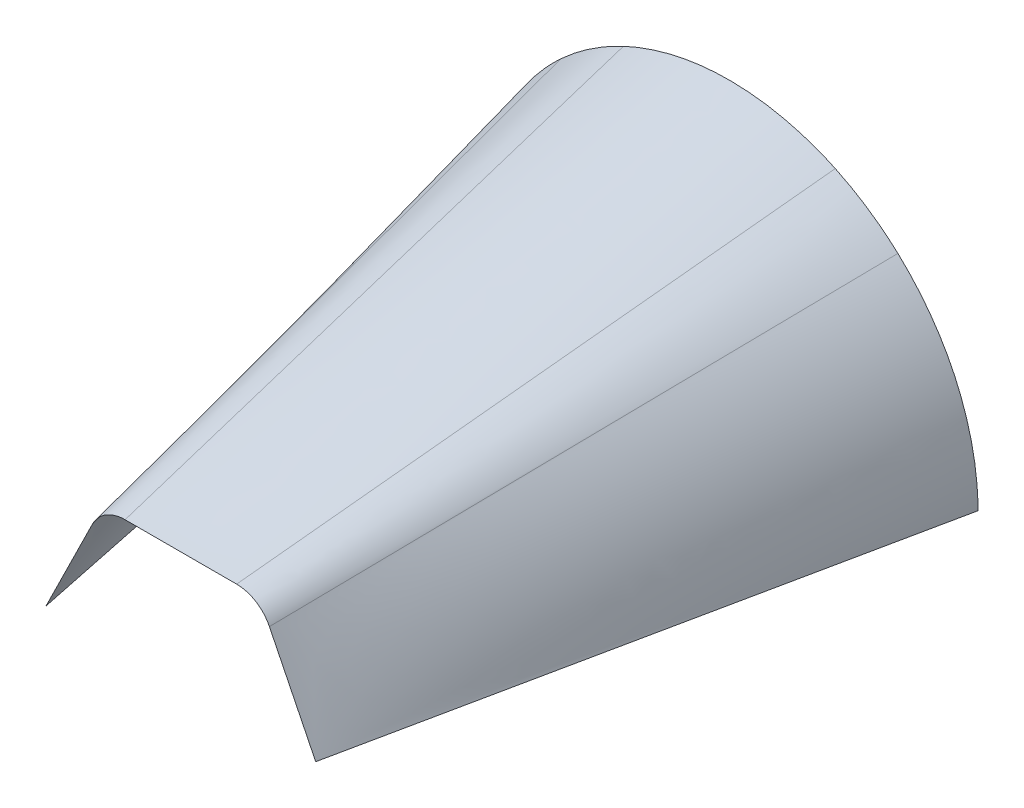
SolidWorks part; units mm, degrees
ref_plane "Front" through (0, 0, 0) normal (0, 0, 1) x (1, 0, 0)
ref_plane "Top" through (0, 0, 0) normal (0, 1, 0) x (1, 0, 0)
ref_plane "Right" through (0, 0, 0) normal (1, 0, 0) x (0, 0, -1)
sketch "Sketch1" plane through (0, 0, 0) normal (0, 0, 1) x (1, 0, 0)
  line L0 (-36.8792, 0) -> (-24.2187, 25.6729)
  line L1 (-15.25, 31.25) -> (15.25, 31.25)
  line L2 (24.2187, 25.6729) -> (36.8792, 0)
  line L3 (0, 31.25) -> (0, 0) construction
  arc A0 (-24.2187, 25.6729) -> (-15.25, 31.25) centre (-15.25, 21.25) cw
  arc A1 (15.25, 31.25) -> (24.2187, 25.6729) centre (15.25, 21.25) cw
  point P6 (0, 31.25)
  dimension "D1" = 10
  dimension "D2" = 30.5
  dimension "D3" = 31.25
  dimension "D4" = 52.5
ref_plane "Plane1" through (0, 0, -150) normal (0, 0, 1) x (1, 0, 0)
sketch "Sketch2" plane through (0, 0, -150) normal (0, 0, 1) x (1, 0, 0)
  arc A0 (-68, 0) -> (68, 0) centre (0, 0) cw
  dimension "D1" = 68
surface "Surface-Loft1"
